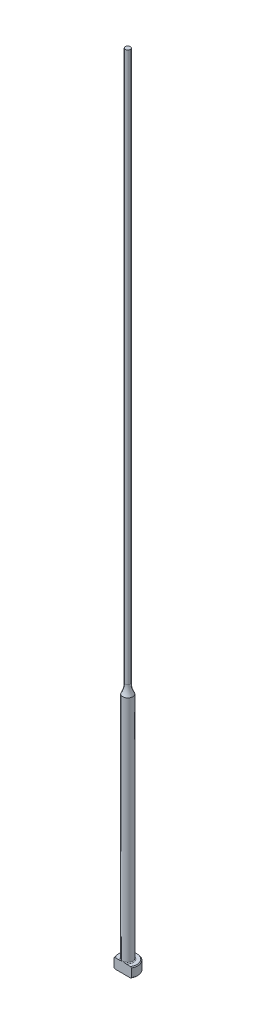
SolidWorks part; units mm, degrees
ref_plane "Front Plane" through (0, 0, 0) normal (0, 0, 1) x (1, 0, 0)
ref_plane "Top Plane" through (0, 0, 0) normal (0, 1, 0) x (1, 0, 0)
ref_plane "Right Plane" through (0, 0, 0) normal (1, 0, 0) x (0, 0, -1)
sketch "Sketch1" plane through (0, 0, 0) normal (0, 0, 1) x (1, 0, 0)
  line L0 (0, 259.9588) -> (0, -15.1925) construction
  line L1 (0, 0) -> (-3.175, 0)
  line L2 (-3.175, 0) -> (-3.175, 3.175)
  line L3 (-3.175, 3.175) -> (-1.5875, 3.175)
  line L4 (-0.7937, 79.2742) -> (-0.7937, 254)
  line L5 (-0.7937, 254) -> (0, 254)
  line L6 (0, 254) -> (0, 0)
  line L7 (-1.5875, 3.175) -> (-1.5875, 76.2)
  arc A0 (-1.5875, 76.2) -> (-0.7937, 79.2742) centre (-7.1437, 79.2742) ccw
  point P13 (-1.5875, 0)
  dimension "D1" = 6.35
  dimension "L" = 254
  dimension "D2" = 3.175
  dimension "H" = 6.35
  dimension "T" = 3.175
  dimension "D" = 1.5875
  dimension "S" = 76.2
revolve "Revolve1" add sketch "Sketch1" angle 360 about L0
chamfer "Chamfer1" distance 0.254 angle 45 2 edges at (0, 3.175, 3.175) (0, 0, 3.175)
fillet "Fillet1" radius 0.254 1 edges at (0, 3.175, 1.5875)
sketch "Sketch2" plane through (0, 0, 0) normal (0, -1, 0) x (1, 0, 0)
  line L0 (-2.7496, 1.5875) -> (2.7496, 1.5875)
  arc A0 (2.7496, 1.5875) -> (-2.7496, 1.5875) centre (0, 0) ccw
  circle A1 centre (0, 0) radius 3.175 construction
  circle A2 centre (0, 0) radius 1.5875 construction
extrude "Cut-Extrude1" cut sketch "Sketch2" against normal through all
